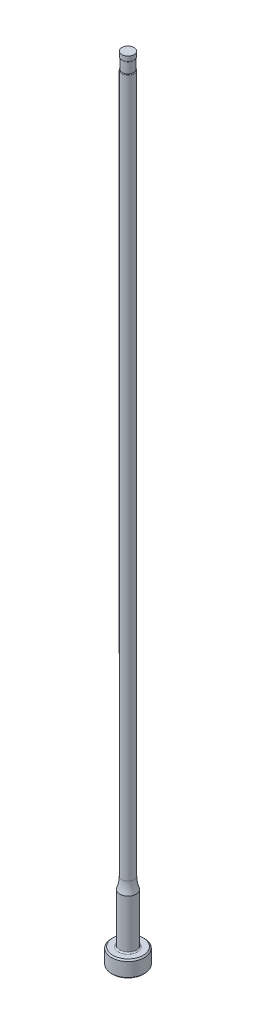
SolidWorks part; units mm, degrees
ref_plane "Front Plane" through (0, 0, 0) normal (0, 0, 1) x (1, 0, 0)
ref_plane "Top Plane" through (0, 0, 0) normal (0, 1, 0) x (1, 0, 0)
ref_plane "Right Plane" through (0, 0, 0) normal (1, 0, 0) x (0, 0, -1)
other "Configuration Table"
sketch "Sketch1" plane through (0, 0, 0) normal (0, 0, 1) x (1, 0, 0)
  line L0 (0, 259.9588) -> (0, -15.1925) construction
  line L1 (0, 0) -> (-3.175, 0)
  line L2 (-3.175, 0) -> (-3.175, 3.175)
  line L3 (-3.175, 3.175) -> (-1.5875, 3.175)
  line L4 (-1.19, 14.9114) -> (-1.19, 152.4)
  line L5 (-1.19, 152.4) -> (0, 152.4)
  line L6 (0, 152.4) -> (0, 0)
  line L7 (-1.5875, 3.175) -> (-1.5875, 12.7)
  arc A1 (-1.5875, 12.7) -> (-1.19, 14.9114) centre (-7.54, 14.9114) ccw
  dimension "D1" = 6.35
  dimension "L" = 152.4
  dimension "D2" = 3.175
  dimension "H" = 6.35
  dimension "T" = 3.175
  dimension "D" = 2.38
  dimension "S" = 12.7
revolve "Revolve1" add sketch "Sketch1" angle 360 about L0
chamfer "Chamfer1" distance 0.254 angle 45 2 edges at (0, 3.175, 3.175) (0, 0, 3.175)
fillet "Fillet1" radius 0.254 1 edges at (0, 3.175, 1.5875)
sketch "Sketch2" plane through (0, 0, 0) normal (0, 0, 1) x (1, 0, 0)
  line L0 (-1.19, 152.4) -> (-1.19, 14.9114) construction
  line L1 (-1.19, 151.384) -> (-1.0884, 151.384)
  line L2 (-1.19, 151.384) -> (-1.19, 149.352)
  line L3 (-1.19, 149.352) -> (-1.0884, 149.352)
  line L4 (-1.0884, 151.384) -> (-1.0884, 149.352)
  line L5 (1.19, 152.4) -> (-1.19, 152.4) construction
  line L6 (0, 153.4483) -> (0, 147.3282) construction
  dimension "D1" = 2.032
  dimension "N" = 1.016
  dimension "FD" = 0.1016
  dimension "D3" = 2.1768
revolve "Vent Relief" cut sketch "Sketch2" angle 360 about L6
sketch "Sketch3" plane through (0, 0, 0) normal (0, 0, 1) x (1, 0, 0)
  line L0 (-1.0884, 150.368) -> (-1.0884, 112.268)
  line L1 (-1.0884, 151.384) -> (-1.0884, 149.352) construction
  line L2 (-1.19, 149.352) -> (-1.19, 14.9114) construction
  line L3 (-1.19, 111.4712) -> (-1.19, 150.368)
  line L4 (-1.19, 150.368) -> (-1.0884, 150.368)
  arc A0 (-1.0884, 112.268) -> (-1.19, 111.4712) centre (-4.2634, 112.268) cw
  dimension "D1" = 3.175
  dimension "D2" = 38.1
extrude "D-Slot" cut sketch "Sketch3" against normal through all both and the other way through all
sketch "Sketch5" plane through (0, 0, 0) normal (0, 0, 1) x (1, 0, 0)
  line L0 (-1.19, 151.384) -> (1.19, 151.384) construction
  line L1 (-1.19, 152.4) -> (-1.1849, 152.4)
  line L2 (-1.19, 152.4) -> (-1.19, 151.384)
  line L3 (-1.19, 151.384) -> (-1.1849, 151.384)
  line L4 (-1.1849, 152.4) -> (-1.1849, 151.384)
  line L5 (0, 152.6877) -> (0, 150.5771) construction
  dimension "VP" = 0.0051
revolve "Vent Diameter" cut sketch "Sketch5" angle 360 about L5
fillet "Fillet2" radius 0.127 2 edges at (1.19, 149.352, 0) (0, 151.384, 1.1849)
sketch "Pocket Sketch" plane through (0, 0, 0) normal (0, 0, 1) x (1, 0, 0)
  line L0 (-3.5719, 0) -> (-3.5719, 3.2004)
  line L1 (-3.5719, 3.2004) -> (-2.1504, 3.2004)
  line L2 (-1.3884, 3.9624) -> (-1.3884, 22.225)
  line L3 (-1.3884, 22.225) -> (0, 22.225)
  line L4 (0, 22.225) -> (0, 0)
  line L5 (0, 0) -> (-3.5719, 0)
  line L6 (0, 12.6104) -> (0, -2.4989) construction
  line L7 (-3.175, 2.921) -> (-3.175, 0.254) construction
  line L8 (2.921, 3.175) -> (-2.921, 3.175) construction
  line L9 (-1.19, 111.4712) -> (-1.19, 14.9114) construction
  line L10 (-2.1504, 3.2004) -> (-1.3884, 3.9624)
  point P3 (-1.3884, 3.2004)
  dimension "D1" = 7.1437
  dimension "D2" = 0.3969
  dimension "D3" = 0.0254
  dimension "D4" = 0.1984
  dimension "D5" = 2.7769
  dimension "D6" = 22.225
